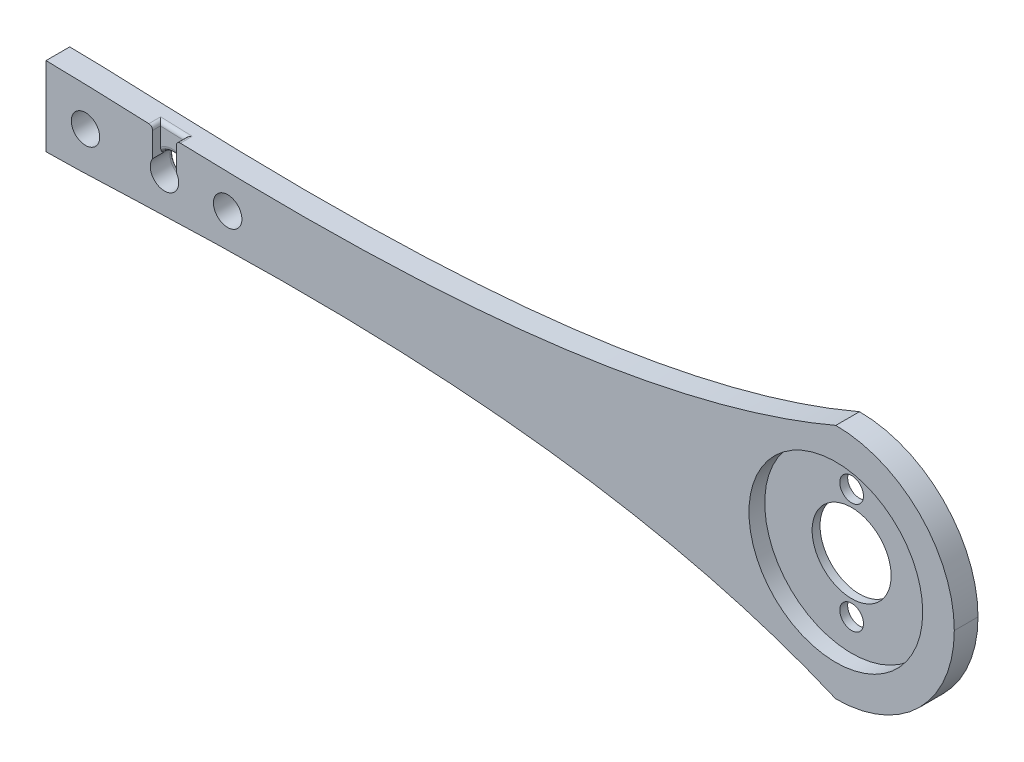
SolidWorks part; units mm, degrees
ref_plane "Plan de face" through (0, 0, 0) normal (0, 0, 1) x (1, 0, 0)
ref_plane "Plan de dessus" through (0, 0, 0) normal (0, 1, 0) x (1, 0, 0)
ref_plane "Plan de droite" through (0, 0, 0) normal (1, 0, 0) x (0, 0, -1)
sketch "Esquisse1" plane through (0, 0, 0) normal (0, 0, 1) x (1, 0, 0)
  line L0 (0, 0) -> (-100, 11.7647)
  line L1 (0, 0) -> (0, 33.5294)
  line L2 (-100, 11.7647) -> (-100, 21.7647)
  line L3 (0, 33.5294) -> (-100, 21.7647)
  line L16 (-15, 16.7647) -> (-15, 31.7647) construction
  line L17 (-15, 31.7647) -> (-15, 16.7647) construction
  line L18 (-15, 16.7647) -> (0, 16.7647) construction
  line L19 (0, 16.7647) -> (-15, 16.7647) construction
  line L20 (-15, 16.7647) -> (-15, 1.7647) construction
  line L21 (-100, 16.7647) -> (0, 16.7647) construction
  line L22 (-100, 21.7647) -> (-100, 11.7647)
  line L23 (-100, 21.7647) -> (-115, 21.7647)
  line L24 (-100, 11.7647) -> (-115, 11.7647)
  line L25 (-115, 21.7647) -> (-115, 11.7647)
  line L26 (-115, 21.7647) -> (-100, 21.7647) construction
  line L27 (-100, 21.7647) -> (-50, 16.7647) construction
  line L28 (-50, 16.7647) -> (-15, 31.7647) construction
  line L29 (-115, 11.7647) -> (-100, 11.7647) construction
  line L30 (-100, 11.7647) -> (-50, 16.7647) construction
  line L31 (-50, 16.7647) -> (-15, 1.7647) construction
  circle A0 centre (-15, 16.7647) radius 5
  circle A1 centre (-15, 16.7647) radius 12.5
  circle A2 centre (-15, 23.7647) radius 1.5
  circle A3 centre (-15, 9.7647) radius 1.5
  circle A4 centre (-110, 16.7647) radius 1.8
  circle A5 centre (-100, 16.7647) radius 1.8
  circle A6 centre (-92, 16.7647) radius 1.8
  spline S0 degree 3 poles (-115, 21.7647) (-100, 21.7647) (-50, 16.7647) (-15, 31.7647) knots 0 0 0 0 1 1 1 1
  spline S1 degree 3 poles (-115, 11.7647) (-100, 11.7647) (-50, 16.7647) (-15, 1.7647) knots 0 0 0 0 1 1 1 1
  point P13 (-50, 16.7647)
  dimension "D3" = 10
  dimension "D16" = 5
  dimension "D1" = 25
  dimension "D7" = 14
  dimension "D9" = 3
  dimension "D10" = 3
  dimension "D12" = 3.6
  dimension "D13" = 3.6
  dimension "D18" = 3.6
  dimension "D2" = 10
  dimension "D4" = 100
  dimension "D5" = 15
  dimension "D6" = 15
  dimension "D8" = 7
  dimension "D11" = 10
  dimension "D14" = 5
  dimension "D15" = 5
  dimension "D17" = 18
extrude "Boss.-Extru.1" add sketch "Esquisse1" along normal blind 3
fillet "Congé1" radius 15 2 edges at (0, 33.5294, 1.5) (0, 0, 1.5)
sketch "Esquisse2" plane through (0, 0, 3) normal (0, 0, 1) x (1, 0, 0)
  line L0 (-15, 31.7647) -> (-15, 1.7647)
  circle A0 centre (-15, 16.7647) radius 11
  arc A1 (-15, 31.7647) -> (-15, 1.7647) centre (-15, 16.7647) cw
  spline S0 degree 3 poles (-115, 11.7647) (-100, 11.7647) (-50, 16.7647) (-15, 1.7647) knots 0 0 0 0 1 1 1 1 construction
  dimension "D1" = 22
extrude "Enlèv. mat.-Extru.1" cut sketch "Esquisse2" against normal blind 2 contours L0 A0 M11 M7 M12 | L0 A0 M12 M7 M11
sketch "Esquisse3" plane through (0, 0, 3) normal (0, 0, 1) x (1, 0, 0)
  line L0 (-101.5, 21.339) -> (-98.5, 21.339)
  line L1 (-101.5, 21.339) -> (-101.5, 16.7647)
  line L2 (-98.5, 21.339) -> (-98.5, 16.7647)
  line L3 (-101.5, 16.7647) -> (-98.5, 16.7647)
  line L5 (-111.8, 16.7647) -> (-98.2, 16.7647) construction
  circle A0 centre (-110, 16.7647) radius 1.8 construction
  circle A1 centre (-100, 16.7647) radius 1.8 construction
  spline S0 degree 3 poles (-115, 21.7647) (-100, 21.7647) (-50, 16.7647) (-15, 31.7647) knots 0 0 0 0 1 1 1 1 construction
  dimension "D1" = 8.5
  dimension "D2" = 3
extrude "Enlèv. mat.-Extru.2" cut sketch "Esquisse3" against normal blind 1
fillet "Congé2" radius 0.5 5 edges at (-98.5, 21.235, 2.5) (-101.5, 21.339, 2.5) (-100, 18.5647, 2) (-98.2, 16.7647, 0)
